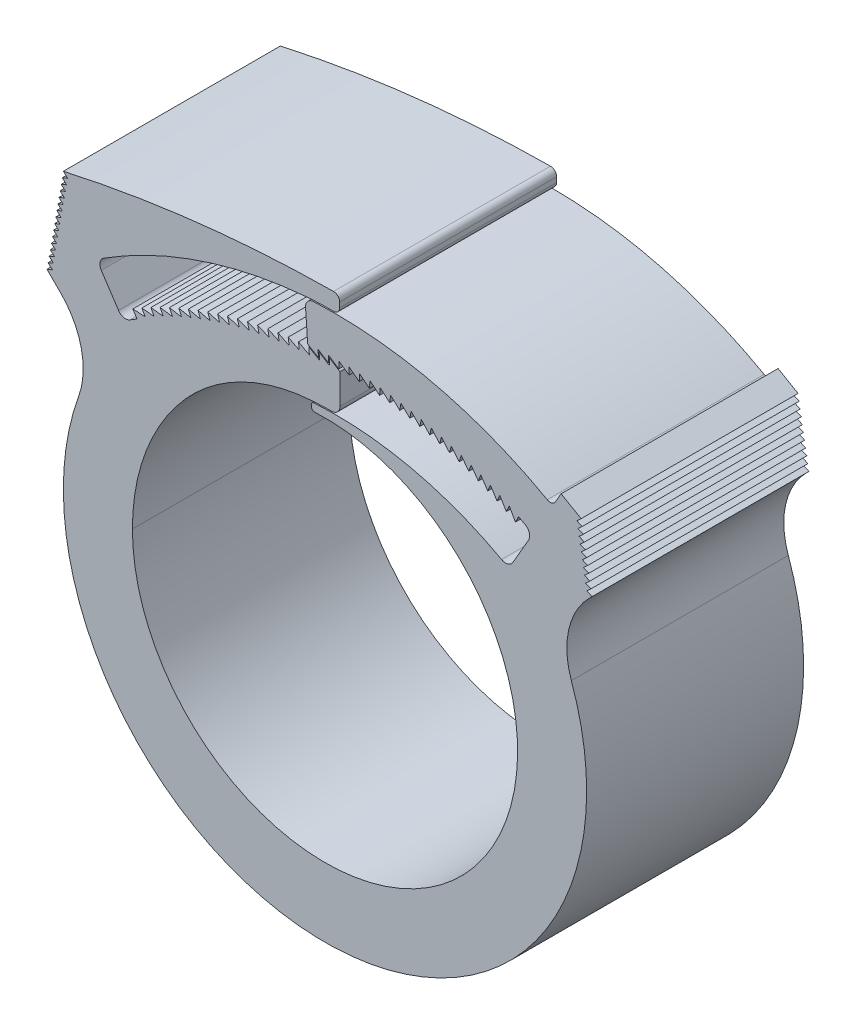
SolidWorks part; units mm, degrees
ref_plane "Front" through (0, 0, 0) normal (0, 0, 1) x (1, 0, 0)
ref_plane "Top" through (0, 0, 0) normal (0, 1, 0) x (1, 0, 0)
ref_plane "Right" through (0, 0, 0) normal (1, 0, 0) x (0, 0, -1)
sketch "Sketch1" plane through (0, 0, 0) normal (0, 0, 1) x (1, 0, 0)
  circle A0 centre (0, 0) radius 4.9609 construction
  circle A1 centre (0, 0) radius 6.7389 construction
sketch "Sketch2" plane through (0, 0, 0) normal (0, 0, 1) x (1, 0, 0)
  line L0 (0, 0) -> (-0.3461, 4.9489) construction
  line L1 (0, 0) -> (0, 4.9609) construction
  line L2 (-0.3461, 4.9489) -> (-0.3599, 5.1468)
  line L3 (0, 0) -> (0.7247, 5.1567) construction
  line L4 (-0.3599, 5.1468) -> (-0.3617, 5.1721) construction
  line L5 (-4.9609, 0) -> (4.9609, 0) construction
  line L6 (0, 0) -> (5.8361, 3.3695) construction
  line L7 (0, 0) -> (-5.8361, 3.3695) construction
  line L8 (-0.3599, 5.1468) -> (-5.8361, 5.1468) construction
  line L9 (0.726, 5.182) -> (0.7247, 5.1567) construction
  line L10 (-3.5902, 3.5902) -> (0, 0) construction
  line L11 (4.7326, 3.9711) -> (5.3527, 5.0452)
  line L12 (4.7326, 3.9711) -> (0, 0) construction
  line L13 (4.7326, 3.9711) -> (5.8054, 3.3517) construction
  line L14 (-0.3599, 5.1468) -> (-0.4464, 6.384) construction
  line L15 (-0.4464, 6.384) -> (-0.5169, 7.3926)
  line L16 (5.8361, 3.3695) -> (6.6348, 4.1681)
  line L17 (5.3527, 5.0452) -> (5.8582, 5.9208) construction
  line L18 (6.6348, 4.1681) -> (6.6348, 3.3695) construction
  line L19 (6.6348, 3.3695) -> (5.8361, 3.3695) construction
  line L20 (6.6348, 4.1681) -> (6.3825, 5.5985)
  line L21 (4.7326, 3.9711) -> (5.3527, 3.9711) construction
  line L22 (5.3527, 3.9711) -> (5.3527, 5.0452) construction
  line L23 (0.726, 5.182) -> (0.7874, 6.3699) construction
  line L24 (0.7874, 6.3699) -> (0.7887, 6.3953) construction
  line L25 (-0.4464, 6.384) -> (-0.4446, 6.3587) construction
  line L26 (0.726, 5.182) -> (6.6348, 4.8768) construction
  line L27 (-6.3771, 3.9105) -> (-5.8361, 3.3695) construction
  line L28 (-5.8361, 3.3695) -> (-6.3771, 3.3695) construction
  line L29 (-6.3771, 3.3695) -> (-6.3771, 3.9105) construction
  line L30 (-5.8361, 3.3695) -> (-4.3421, 2.5069)
  arc A0 (-5.8361, 3.3695) -> (5.8361, 3.3695) centre (0, 0) ccw
  circle A1 centre (0, 0) radius 6.7389 construction
  arc A2 (-4.9609, 0) -> (-0.3461, 4.9489) centre (0, 0) ccw
  circle A3 centre (0, 0) radius 4.9609 construction
  arc A4 (-0.3617, 5.1721) -> (0.726, 5.182) centre (0.2636, -3.7694) cw construction
  arc A5 (-0.3599, 5.1468) -> (4.7326, 3.9711) centre (0.2636, -3.7694) cw
  arc A6 (-4.9609, 0) -> (-3.5902, 3.5902) centre (0.4263, 0) cw construction
  arc A7 (-3.5902, 3.5902) -> (-0.3617, 5.1721) centre (-0.0284, 0.4064) cw construction
  arc A8 (-0.4464, 6.384) -> (5.3527, 5.0452) centre (0.2636, -3.7694) cw
  arc A9 (-0.5169, 7.3926) -> (6.3825, 5.5985) centre (0.2636, -3.7694) cw
  arc A10 (0.7874, 6.3699) -> (-6.3771, 3.9105) centre (0.2636, -3.7694) ccw construction
  arc A11 (-4.9609, 0) -> (-4.3421, 2.5069) centre (0.4263, 0) cw
extrude "Boss-Extrude1" add sketch "Sketch2" along normal mid plane 5.588
sketch "Sketch3" plane through (0, 0, 0) normal (0, 0, 1) x (1, 0, 0)
  line L0 (-0.4464, 6.384) -> (-0.1691, 6.221)
  line L1 (-0.1792, 6.3992) -> (-0.4464, 6.384) construction
  line L2 (-0.1691, 6.221) -> (-0.1792, 6.3992)
  line L3 (-0.1792, 6.3992) -> (-0.3712, 6.512)
  line L4 (-0.3712, 6.512) -> (-0.4464, 6.384)
  arc A0 (5.3527, 5.0452) -> (-0.4464, 6.384) centre (0.2636, -3.7694) ccw construction
  arc A1 (5.3527, 5.0452) -> (-0.4464, 6.384) centre (0.2636, -3.7694) ccw construction
extrude "Boss-Extrude2" add sketch "Sketch3" along normal mid plane 5.588
pattern_curve "CrvPattern14" of "Boss-Extrude2" parameters "D1"=21, "D3"=0.2676, "D2"=1, "D4"=2.54
sketch "Sketch6" plane through (0, 0, 0) normal (0, 0, 1) x (1, 0, 0)
  line L0 (-5.8361, 3.3695) -> (-6.2172, 3.7506)
  line L1 (-6.3771, 3.9105) -> (-5.8361, 3.3695) construction
  line L2 (-4.3421, 2.5069) -> (-5.8361, 3.3695)
  line L3 (0.3566, 6.23) -> (0.3559, 6.4084) construction
  line L4 (0.3875, 5.1931) -> (0.3835, 6.1818) construction
  line L5 (-0.4464, 6.384) -> (-0.1691, 6.221) construction
  line L6 (0.1205, 6.1823) -> (0.1137, 6.4077) construction
  line L7 (0.3836, 6.1572) -> (0.3875, 5.1931)
  line L8 (-0.1691, 6.221) -> (-0.1792, 6.3992) construction
  line L9 (-0.1792, 6.3992) -> (0.0937, 6.229) construction
  line L10 (0.0937, 6.229) -> (0.0883, 6.4073) construction
  line L11 (0.0883, 6.4073) -> (0.3566, 6.23) construction
  line L13 (-0.4593, 6.3621) -> (-0.1411, 6.1751) construction
  line L14 (-0.1411, 6.1751) -> (-0.1511, 6.3517) construction
  line L15 (-0.1511, 6.3517) -> (0.1205, 6.1823) construction
  line L16 (0.1205, 6.1823) -> (0.1151, 6.3591) construction
  line L17 (0.1151, 6.3591) -> (0.3835, 6.1818) construction
  line L22 (0.3835, 6.1818) -> (0.3784, 7.4192) construction
  line L23 (0.3784, 7.4192) -> (0.3783, 7.4446) construction
  line L24 (-0.3599, 5.1468) -> (-0.3617, 5.1721) construction
  line L25 (0.3783, 7.4446) -> (0.3765, 7.8911) construction
  line L26 (-0.5169, 7.3926) -> (-0.5187, 7.4179) construction
  line L27 (-0.4464, 6.384) -> (-0.5169, 7.3926) construction
  line L32 (0.3835, 6.1818) -> (0.3479, 7.3534) construction
  line L33 (0.3566, 6.23) -> (0.3225, 7.3526) construction
  arc A0 (-0.3617, 5.1721) -> (-3.5902, 3.5902) centre (-0.0284, 0.4064) ccw construction
  arc A1 (-0.3617, 5.1721) -> (-3.5902, 3.5902) centre (-0.0284, 0.4064) ccw
  arc A2 (0.726, 5.182) -> (-0.3617, 5.1721) centre (0.2636, -3.7694) ccw construction
  arc A3 (-3.5902, 3.5902) -> (-4.9609, 0) centre (0.4263, 0) ccw construction
  arc A4 (-3.5902, 3.5902) -> (-4.3421, 2.5069) centre (0.4263, 0) ccw
  arc A5 (0.3875, 5.1931) -> (-0.3617, 5.1721) centre (0.2636, -3.7694) ccw
  arc A6 (5.3527, 5.0452) -> (-0.4464, 6.384) centre (0.2636, -3.7694) ccw construction
  arc A8 (6.3825, 5.5985) -> (-0.5169, 7.3926) centre (0.2636, -3.7694) ccw construction
  arc A14 (0.7758, 6.1447) -> (-6.2296, 3.7399) centre (0.2636, -3.7694) ccw
  arc A15 (0.3836, 6.1572) -> (-6.2172, 3.7506) centre (0.2636, -3.7694) ccw
extrude "Boss-Extrude3" add sketch "Sketch6" along normal mid plane 5.588
sketch "Sketch7" plane through (0, 0, 0) normal (0, 0, 1) x (1, 0, 0)
  line L0 (0.3835, 6.1818) -> (0.1151, 6.3591)
  line L1 (0.1151, 6.3591) -> (0.1205, 6.1823)
  line L2 (0.1205, 6.1823) -> (0.1151, 6.3591) construction
  line L3 (0.1205, 6.1823) -> (0.1245, 6.0524)
  line L4 (0.3835, 6.1818) -> (0.1245, 6.0524) construction
  line L6 (0.3835, 6.1818) -> (0.384, 6.0603)
  line L7 (0.3836, 6.1572) -> (0.3875, 5.1931) construction
  line L8 (0.1245, 6.0524) -> (0.384, 6.0603)
  line L11 (-5.8361, 3.3695) -> (-6.2172, 3.7506) construction
  arc A0 (5.3527, 5.0452) -> (-0.4464, 6.384) centre (0.2636, -3.7694) ccw construction
  arc A1 (5.3527, 5.0452) -> (-6.3951, 3.9285) centre (0.2636, -3.7694) ccw construction
  dimension "D1" = 60
extrude "Boss-Extrude4" add sketch "Sketch7" along normal mid plane 5.588
pattern_curve "CrvPattern15" of "Boss-Extrude4" parameters "D1"=21, "D3"=0.2676, "D2"=1, "D4"=2.54
sketch "Sketch15" plane through (0, 0, 0) normal (0, 0, 1) x (1, 0, 0)
  line L0 (4.7326, 3.9711) -> (5.8582, 5.9208) construction
  line L1 (4.7326, 3.9711) -> (5.3527, 5.0452) construction
  line L2 (5.8582, 5.9208) -> (6.0815, 6.3074)
  line L3 (6.4681, 6.0842) -> (6.597, 6.0098)
  line L4 (6.4681, 6.0842) -> (6.0815, 6.3074)
  line L5 (6.0815, 6.3074) -> (6.2103, 6.233) construction
  line L6 (6.6348, 4.1681) -> (6.8787, 4.4121)
  line L7 (5.8361, 3.3695) -> (6.6348, 4.1681) construction
  line L8 (6.2103, 6.233) -> (6.3392, 6.1586) construction
  line L9 (6.3392, 6.1586) -> (6.4681, 6.0842) construction
  line L10 (6.597, 6.0098) -> (6.8787, 4.4121)
  line L11 (6.6348, 4.1681) -> (6.3825, 5.5985) construction
  line L12 (6.6348, 4.1681) -> (6.3825, 5.5985)
  line L14 (0.3783, 7.4446) -> (0.3765, 7.8911) construction
  arc A0 (6.3825, 5.5985) -> (-0.5169, 7.3926) centre (0.2636, -3.7694) ccw construction
  arc A1 (6.3825, 5.5985) -> (5.8582, 5.9208) centre (0.2636, -3.7694) ccw
extrude "Boss-Extrude6" add sketch "Sketch15" along normal mid plane 5.588
sketch "Sketch14" plane through (0, 0, 0) normal (0, 0, 1) x (1, 0, 0)
  line L0 (-5.1998, 4.5193) -> (-5.8823, 5.5549)
  line L1 (-5.1998, 4.5193) -> (-12.0563, 0) construction
  line L2 (0.3783, 7.4446) -> (0.3765, 7.8911)
  line L3 (0.3835, 6.1818) -> (0.3784, 7.4192) construction
  line L4 (-4.9736, 4.958) -> (-5.3429, 4.7364) construction
  line L5 (-4.9736, 4.958) -> (-4.8445, 4.7429) construction
  line L6 (-5.1998, 4.5193) -> (-5.8361, 3.3695)
  line L7 (-5.8361, 3.3695) -> (-7.1614, 4.6948)
  line L8 (-5.8361, 3.3695) -> (-6.2172, 3.7506) construction
  line L9 (-7.1614, 4.6948) -> (-6.7388, 7.0913)
  line L11 (6.6348, 4.1681) -> (6.3825, 5.5985) construction
  line L12 (5.3527, 5.0452) -> (6.4461, 5.238) construction
  line L13 (4.7326, 3.9711) -> (5.3527, 5.0452) construction
  line L15 (-5.8823, 5.5549) -> (-6.9757, 5.7477) construction
  line L16 (6.597, 6.0098) -> (6.8787, 4.4121) construction
  arc A0 (0.3836, 6.1572) -> (-6.2172, 3.7506) centre (0.2636, -3.7694) ccw construction
  arc A1 (-4.8445, 4.7429) -> (-5.1998, 4.5193) centre (0.2636, -3.7694) ccw construction
  arc A2 (0.3826, 6.4081) -> (-4.9736, 4.958) centre (0.2636, -3.7694) ccw construction
  arc A3 (0.3765, 7.8911) -> (-6.7388, 7.0913) centre (0.5122, -25.3628) ccw
  arc A4 (-4.8422, 4.7443) -> (-6.2172, 3.7506) centre (0.2636, -3.7694) ccw construction
  arc A5 (-5.8823, 5.5549) -> (-0.5187, 7.4179) centre (0.4713, -4.0846) cw
  arc A6 (5.3527, 5.0452) -> (-6.3951, 3.9285) centre (0.2636, -3.7694) ccw construction
  arc A7 (5.3527, 5.0452) -> (4.9849, 5.2475) centre (0.2636, -3.7694) ccw construction
  arc A8 (-0.5187, 7.4179) -> (0.3783, 7.4446) centre (0.1679, -0.5594) cw
  arc A9 (-4.8422, 4.7443) -> (-6.2172, 3.7506) centre (0.2636, -3.7694) ccw construction
extrude "Boss-Extrude5" add sketch "Sketch14" along normal mid plane 5.588
fillet "Fillet1" radius 1.9844 2 edges at (5.8361, 3.3695, 0) (-5.8361, 3.3695, 0)
sketch "Sketch16" plane through (0, 0, 0) normal (0, 0, 1) x (1, 0, 0)
  line L0 (6.597, 6.0098) -> (6.4857, 5.9078)
  line L1 (6.4857, 5.9078) -> (6.6252, 5.85)
  line L2 (6.8787, 4.4121) -> (6.597, 6.0098) construction
  line L3 (6.4857, 5.9078) -> (6.6111, 5.9299) construction
  line L4 (6.8787, 4.4121) -> (6.597, 6.0098) construction
  line L5 (6.597, 6.0098) -> (6.6252, 5.85)
extrude "Cut-Extrude1" cut sketch "Sketch16" against normal through all and the other way through all
pattern_linear "LPattern1" count 10 spacing 0.1622 along (0.1736, -0.9848, 0) of "Cut-Extrude1"
sketch "Sketch17" plane through (0, 0, 0) normal (0, 0, 1) x (1, 0, 0)
  line L0 (-6.7388, 7.0913) -> (-6.6275, 6.9893)
  line L1 (-6.6275, 6.9893) -> (-6.767, 6.9315)
  line L2 (-6.7388, 7.0913) -> (-7.1614, 4.6948) construction
  line L3 (-6.767, 6.9315) -> (-6.7388, 7.0913)
  line L4 (-6.6275, 6.9893) -> (-6.7529, 7.0114) construction
  line L5 (6.597, 6.0098) -> (6.6252, 5.85) construction
  dimension "D1" = 65
  dimension "D2" = 32.5
extrude "Cut-Extrude2" cut sketch "Sketch17" against normal through all and the other way through all
pattern_linear "LPattern2" count 15 spacing 0.1622 along (-0.1736, -0.9848, 0) of "Cut-Extrude2"
fillet "Fillet2" radius 0.217 6 edges at (5.3527, 5.0452, 0) (4.7326, 3.9711, 0) (-5.8823, 5.5549, 0) (-5.1998, 4.5193, 0) (0.3875, 5.1931, 0) (-0.5169, 7.3926, 0)
fillet "Fillet3" radius 0.1563 3 edges at (5.8582, 5.9208, 0) (0.3783, 7.4446, 0) (0.3765, 7.8911, 0)
fillet "Fillet4" radius 0.0794 2 edges at (-0.3461, 4.9489, 0) (-0.3599, 5.1468, 0)
equation "\"D9@Sketch2\" = \"Clamp ID@Sketch1\" * .125"
equation "\"D2@Sketch2\" = \"Clamp ID@Sketch1\" * .02"
equation "\"D10@Sketch2\" = ( \"D9@Sketch2\" - .002 ) - ( ( \"D9@Sketch2\" - .002 ) * .15 ) "
equation "\"D1@Boss-Extrude2\" = \"Band Wd@Boss-Extrude1\""
equation "\"D1@Sketch3\" = ( \"D9@Sketch2\" - .002 ) * .15"
equation "\"D2@Sketch3\" = \"D1@Sketch3\" * 1.5"
equation "\"D3@CrvPattern14\" = \"D2@Sketch3\""
equation "\"D2@Sketch6\" =\"D2@Sketch2\" * 2.25"
equation "\"D1@Boss-Extrude3\" = \"Band Wd@Boss-Extrude1\""
equation "\"D1@Boss-Extrude4\" = \"Band Wd@Boss-Extrude1\""
equation "\"D3@CrvPattern15\" = \"D3@CrvPattern14\""
equation "\"D5@Sketch6\" = \"D3@Sketch6\""
equation "\"D1@CrvPattern14\" = ( ( \"D15@Sketch2\" - ( \"D2@Sketch3\" * 1.5 ) ) / \"D2@Sketch3\" )"
equation "\"D1@CrvPattern15\" = \"D1@CrvPattern14\""
equation "\"D2@Sketch14\" = \"D15@Sketch2\" -  ( \"D2@Sketch3\" * \"D1@CrvPattern14\" ) "
equation "\"D3@Sketch14\" = \"D2@Sketch14\""
equation "\"D1@Boss-Extrude5\" = \"Band Wd@Boss-Extrude1\""
equation "\"D1@Fillet1\" = \"Clamp ID@Sketch1\" * .2"
equation "\"D1@Boss-Extrude6\" = \"Band Wd@Boss-Extrude1\""
equation "\"D1@Sketch14\" = \"D2@Sketch3\" * \"D1@CrvPattern15\""
equation "\"D4@Sketch16\" = \"D3@Sketch16\" / 10"
equation "\"D4@Sketch14\" = \"D6@Sketch14\" * 1.5"
equation "\"D3@LPattern1\" = \"D4@Sketch16\""
equation "\"D3@LPattern2\" = \"D4@Sketch16\""
equation "\"D1@Fillet2\" = \"D9@Sketch2\" * .175"
equation "\"D1@Fillet3\" = \"D2@Sketch6\" * .35"
equation "\"D1@Fillet4\" = \"D2@Sketch2\" * .4"
